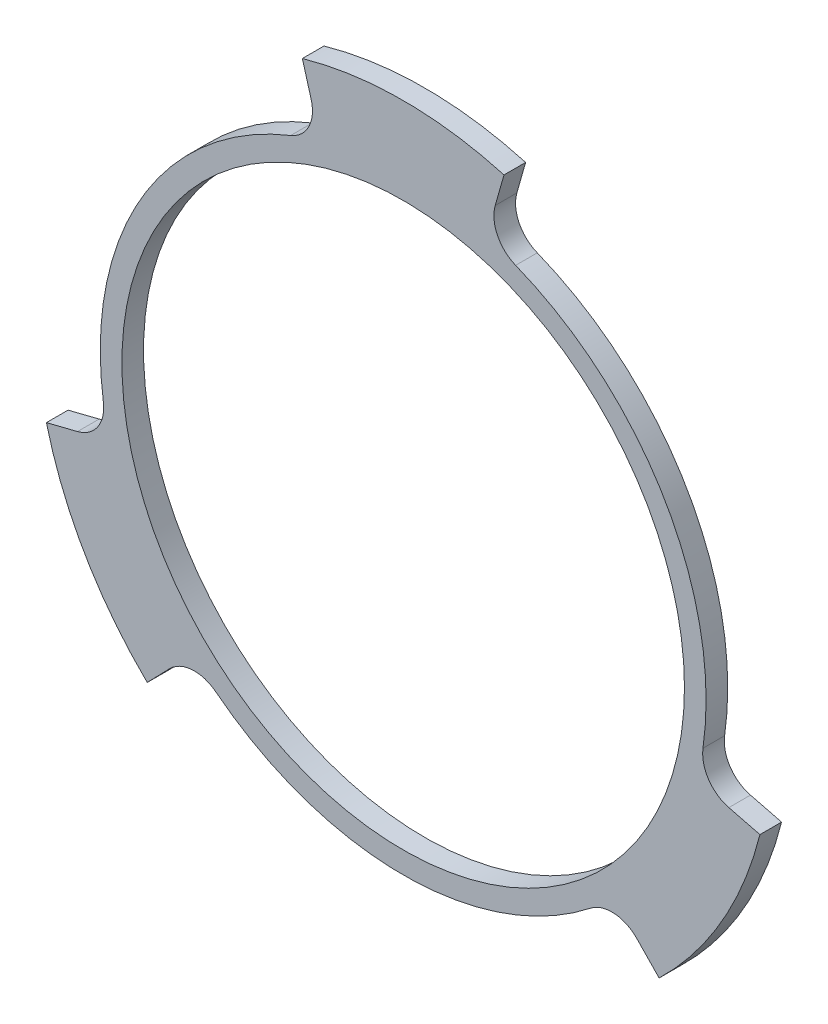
SolidWorks part; units mm, degrees
ref_plane "Front Plane" through (0, 0, 0) normal (0, 0, 1) x (1, 0, 0)
ref_plane "Top Plane" through (0, 0, 0) normal (0, 1, 0) x (1, 0, 0)
ref_plane "Right Plane" through (0, 0, 0) normal (1, 0, 0) x (0, 0, -1)
sketch "Sketch1" plane through (0, 0, 0) normal (0, 0, 1) x (1, 0, 0)
  line L0 (0, 0) -> (0, 38.5046) construction
  line L1 (0, 0) -> (47.0716, -27.1768) construction
  line L2 (0, 0) -> (-45.4038, -26.2139) construction
  line L3 (-7.3971, 25.954) -> (-6.0917, 21.3739)
  line L4 (7.3971, 25.954) -> (6.0917, 21.3739)
  line L5 (26.1753, -6.5709) -> (21.5562, -5.4113)
  line L6 (18.7783, -19.383) -> (15.4644, -15.9625)
  line L7 (-18.7783, -19.383) -> (-15.4644, -15.9625)
  line L8 (-26.1753, -6.5709) -> (-21.5562, -5.4113)
  circle A0 centre (0, 0) radius 20.6375
  arc A1 (26.1753, -6.5709) -> (18.7783, -19.383) centre (0, 0) cw
  arc A2 (-18.7783, -19.383) -> (-26.1753, -6.5709) centre (0, 0) cw
  arc A3 (-7.3971, 25.954) -> (7.3971, 25.954) centre (0, 0) cw
  arc A4 (-21.5562, -5.4113) -> (-6.0917, 21.3739) centre (0, 0) cw
  arc A5 (21.5562, -5.4113) -> (6.0917, 21.3739) centre (0, 0) ccw
  arc A6 (15.4644, -15.9625) -> (-15.4644, -15.9625) centre (0, 0) cw
  dimension "D1" = 41.275
  dimension "D2" = 26.9875
  dimension "D4" = 120
  dimension "D5" = 120
extrude "Extrude1" add sketch "Sketch1" along normal blind 1.5875 contours A6 L6 A1 L5 A5 L4 A3 L3 A4 L8 A2 L7 A0
fillet "Fillet1" radius 2.54 6 edges at (-6.0917, 21.3739, 0.7937) (21.5562, -5.4113, 0.7937) (6.0917, 21.3739, 0.7937) (15.4644, -15.9625, 0.7937) (-15.4644, -15.9625, 0.7937) (-21.5562, -5.4113, 0.7937)
